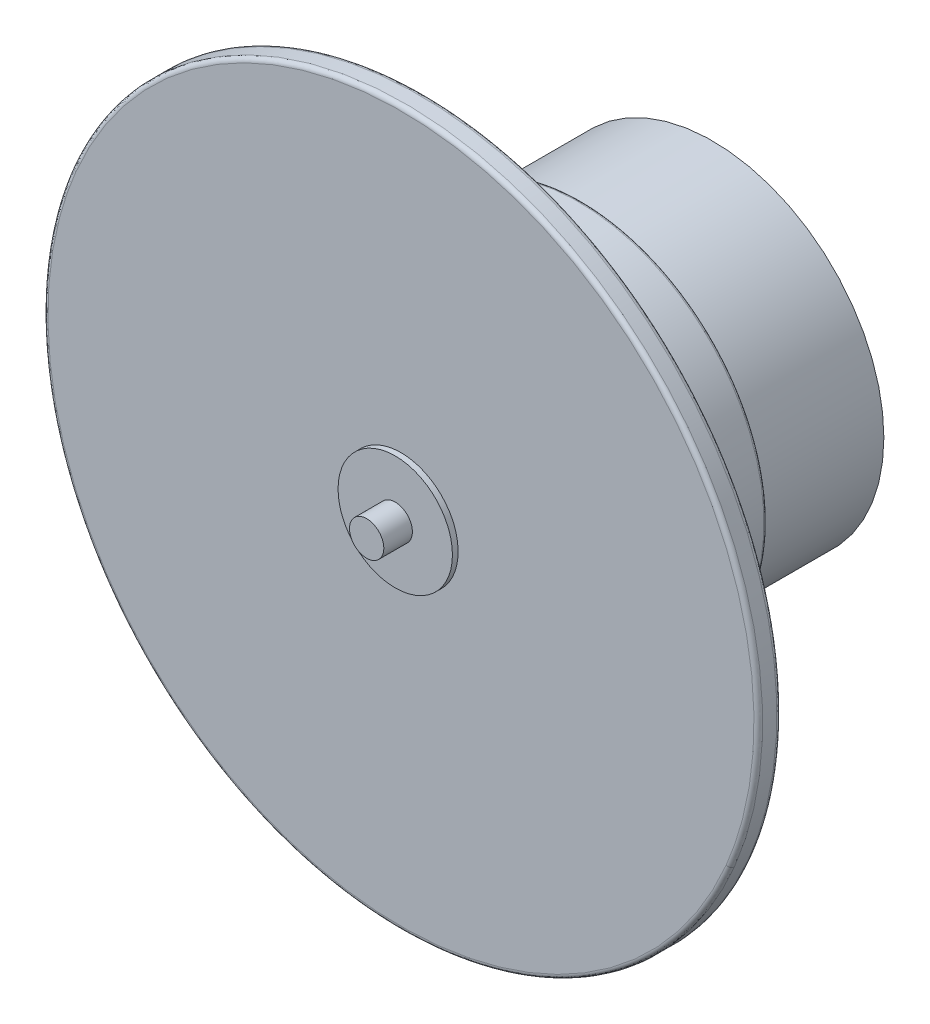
SolidWorks part; units mm, degrees
ref_plane "Alzado" through (0, 0, 0) normal (0, 0, 1) x (1, 0, 0)
ref_plane "Planta" through (0, 0, 0) normal (0, 1, 0) x (1, 0, 0)
ref_plane "Vista lateral" through (0, 0, 0) normal (1, 0, 0) x (0, 0, -1)
imported_body "A1255 (1).IGS<1>"
delete or keep bodies "Sólido-Eliminar/Conservar 1" type delete bodies bodies 103
ref_plane "Plano1" through (0, 0, 30) normal (0, 0, 1) x (1, 0, 0)
sketch "Croquis2" plane through (0, 0, 30) normal (0, 0, 1) x (1, 0, 0)
  circle A0 centre (0, 0) radius 59.944
  dimension "D1" = 119.888
extrude "Saliente-Extruir1" add sketch "Croquis2" against normal blind 45.974 separate body
